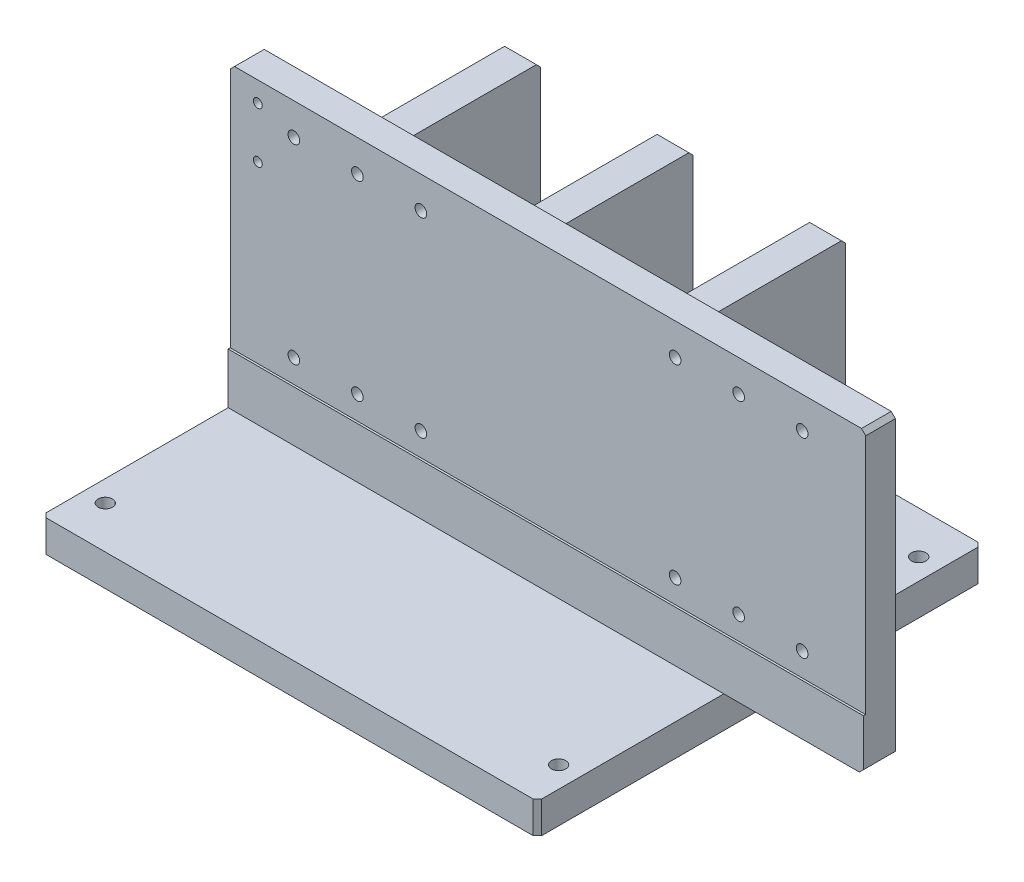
SolidWorks part; units mm, degrees
ref_plane "정면" through (0, 0, 0) normal (0, 0, 1) x (1, 0, 0)
ref_plane "윗면" through (0, 0, 0) normal (0, 1, 0) x (1, 0, 0)
ref_plane "우측면" through (0, 0, 0) normal (1, 0, 0) x (0, 0, -1)
sketch "스케치1" plane through (0, 0, 0) normal (0, 1, 0) x (1, 0, 0)
  line L1 (-117, 105) -> (117, 105)
  line L2 (-117, 105) -> (-117, -105)
  line L3 (-117, -105) -> (117, -105)
  line L4 (117, 105) -> (117, -105)
  line L5 (-117, 105) -> (117, -105) construction
  line L6 (-117, -105) -> (117, 105) construction
  point P0 (0, 0)
  dimension "D1" = 234
  dimension "D2" = 210
extrude "보스-돌출1" add sketch "스케치1" along normal blind 15
sketch "스케치2" plane through (0, 15, 0) normal (0, 1, 0) x (1, 0, 0)
  line L0 (-117, 105) -> (-117, -105) construction
  line L1 (-117, -2) -> (183, -2)
  line L2 (-117, -2) -> (-117, -17)
  line L3 (-117, -17) -> (183, -17)
  line L4 (183, -2) -> (183, -17)
  line L5 (117, 105) -> (-117, 105) construction
  dimension "D1" = 15
  dimension "D2" = 300
  dimension "D3" = 107
extrude "보스-돌출2" add sketch "스케치2" along normal blind 140 separate body
sketch "스케치3" plane through (0, 0, 17) normal (0, 0, 1) x (1, 0, 0)
  line L0 (183, 155) -> (183, 15) construction
  line L1 (-117, 155) -> (183, 155)
  line L2 (-117, 155) -> (-117, 39)
  line L3 (-117, 39) -> (183, 39)
  line L4 (183, 155) -> (183, 39)
  line L5 (-117, 15) -> (117, 15) construction
  dimension "D1" = 24
extrude "컷-돌출1" cut sketch "스케치3" against normal blind 1
sketch "스케치4" plane through (0, 15, 0) normal (0, 1, 0) x (1, 0, 0)
  line L1 (-79.5, 78) -> (-64.5, 78)
  line L2 (-79.5, 78) -> (-79.5, -2)
  line L3 (-79.5, -2) -> (-64.5, -2)
  line L4 (-64.5, 78) -> (-64.5, -2)
  line L5 (183, -2) -> (-117, -2) construction
  line L6 (-117, 105) -> (-117, -105) construction
  line L7 (-7.5, 78) -> (7.5, 78)
  line L8 (-7.5, 78) -> (-7.5, -2)
  line L9 (-7.5, -2) -> (7.5, -2)
  line L10 (7.5, 78) -> (7.5, -2)
  line L11 (64.5, 78) -> (79.5, 78)
  line L12 (64.5, 78) -> (64.5, -2)
  line L13 (64.5, -2) -> (79.5, -2)
  line L14 (79.5, 78) -> (79.5, -2)
  dimension "D1" = 37.5
  dimension "D2" = 15
  dimension "D3" = 57
  dimension "D4" = 57
  dimension "D5" = 80
extrude "보스-돌출3" add sketch "스케치4" along normal blind 120 separate body
sketch "스케치5" plane through (79.5, 0, 0) normal (1, 0, 0) x (0, 0, -1)
  line L0 (78, 135) -> (76, 135)
  line L1 (-2, 135) -> (78, 135) construction
  line L2 (76, 135) -> (78, 133)
  line L3 (78, 135) -> (78, 15) construction
  line L4 (78, 133) -> (78, 135)
  dimension "D1" = 2
  dimension "D2" = 2
extrude "컷-돌출2" cut sketch "스케치5" against normal through all
hole_wizard "M8 나사 구멍1" positions "스케치6" profile "스케치7" tap size "M8" standard "ISO"
sketch "스케치6" plane through (0, 15, 0) normal (0, 1, 0) x (1, 0, 0)
  line L0 (117, -105) -> (117, 105) construction
  line L1 (117, 105) -> (-117, 105) construction
  point P0 (-107, 85)
  point P2 (107, 85)
  point P4 (-107, -85)
  point P6 (107, -85)
  dimension "D1" = 214
  dimension "D2" = 10
  dimension "D3" = 20
  dimension "D4" = 170
sketch "스케치7" plane through (-107, 15, -85) normal (1, 0, 0) x (0, 0, 1)
  line L0 (0, 0) -> (0, 15)
  line L1 (0, 15) -> (3.4, 15)
  line L2 (3.4, 15) -> (3.4, 0)
  line L5 (3.4, 0) -> (0, 0)
  line L11 (0, -6.35) -> (0, 107.95) construction
  dimension "관통 탭 드릴 지름" = 6.8
  dimension "관통 탭 드릴 깊이" = 15
hole_wizard "Ø6.0mm 맞춤핀 구멍1" positions "스케치8" profile "스케치9" hole size "Ø6.0" standard "ISO"
sketch "스케치8" plane through (0, 0, 0) normal (0, -1, 0) x (-1, 0, 0)
  line L0 (0, 0) -> (-155.2193, 0) construction
  line L1 (-117, -105) -> (-117, 105) construction
  point P6 (-107, 0)
  point P8 (107, 0)
  dimension "D1" = 214
  dimension "D2" = 10
sketch "스케치9" plane through (-107, 0, 0) normal (1, 0, 0) x (0, 0, -1)
  line L0 (0, 0) -> (0, 11.8026)
  line L1 (0, 11.8026) -> (3, 10)
  line L2 (3, 10) -> (3, 0)
  line L5 (3, 0) -> (0, 0)
  line L10 (0, 11.8026) -> (-3, 10) construction
  line L11 (0, -6.35) -> (0, 107.95) construction
  dimension "구멍 지름" = 6
  dimension "구멍 깊이" = 10
  dimension "드릴 각도" = 118
hole_wizard "M5 나사 구멍1" positions "스케치10" profile "스케치11" tap size "M5" standard "ISO"
sketch "스케치10" plane through (-117, 0, 0) normal (-1, 0, 0) x (0, 0, 1)
  line L0 (-105, 15) -> (-105, 0) construction
  line L1 (-105, 0) -> (105, 0) construction
  point P0 (-45, 7.5)
  point P2 (-9, 7.5)
  dimension "D1" = 36
  dimension "D2" = 60
  dimension "D3" = 7.5
sketch "스케치11" plane through (-117, 7.5, -45) normal (0, 1, 0) x (0, 0, 1)
  line L0 (0, 0) -> (0, 13.2618)
  line L1 (0, 13.2618) -> (2.1, 12)
  line L2 (2.1, 12) -> (2.1, 0)
  line L5 (2.1, 0) -> (0, 0)
  line L10 (0, 13.2618) -> (-2.1, 12) construction
  line L11 (0, -6.35) -> (0, 107.95) construction
  dimension "탭 드릴 지름" = 4.2
  dimension "탭 드릴 깊이" = 12
  dimension "드릴 각도" = 118
hole_wizard "M5 소켓 머리 캡 나사용 카운터보어1" positions "스케치12" profile "스케치13" counterbore size "M5" standard "KS"
sketch "스케치12" plane through (0, 0, 2) normal (0, 0, -1) x (-1, 0, 0)
  line L0 (117, 155) -> (117, 15) construction
  line L1 (-183, 15) -> (117, 15) construction
  point P0 (27, 140)
  point P2 (57, 140)
  point P4 (87, 140)
  point P6 (27, 50)
  point P8 (57, 50)
  point P10 (87, 50)
  dimension "D1" = 30
  dimension "D2" = 30
  dimension "D3" = 30
  dimension "D4" = 90
  dimension "D5" = 35
sketch "스케치13" plane through (-27, 140, 2) normal (1, 0, 0) x (0, 1, 0)
  line L0 (0, 0) -> (0, 103)
  line L1 (0, 103) -> (2.75, 103)
  line L3 (2.75, 103) -> (2.75, 7)
  line L4 (2.75, 7) -> (4.75, 7)
  line L5 (4.75, 7) -> (4.75, 0)
  line L7 (4.75, 0) -> (0, 0)
  line L11 (0, -6.35) -> (0, 107.95) construction
  dimension "관통 구멍 지름" = 5.5
  dimension "관통 구멍 깊이" = 103
  dimension "카운터보어 지름" = 9.5
  dimension "카운터보어 깊이" = 7
pattern_linear "선형 패턴1" count 2 spacing 180 along (1, 0, 0) of "M5 소켓 머리 캡 나사용 카운터보어1"
hole_wizard "M5 나사 구멍2" positions "스케치14" profile "스케치15" tap size "M5" standard "ISO"
sketch "스케치14" plane through (0, 0, 2) normal (0, 0, -1) x (-1, 0, 0)
  line L0 (-183, 155) -> (117, 155) construction
  line L1 (117, 155) -> (117, 15) construction
  point P0 (104, 145.5)
  point P2 (104, 121.5)
  dimension "D1" = 24
  dimension "D2" = 9.5
  dimension "D3" = 13
sketch "스케치15" plane through (-104, 145.5, 2) normal (1, 0, 0) x (0, 1, 0)
  line L0 (0, 0) -> (0, 103)
  line L1 (0, 103) -> (2.525, 103)
  line L2 (2.1, 102.575) -> (2.1, 0.425)
  line L3 (2.1, 0.425) -> (2.525, 0)
  line L5 (2.525, 0) -> (0, 0)
  line L6 (-2.1, 0.425) -> (-2.525, 0) construction
  line L7 (2.525, 103) -> (2.1, 102.575)
  line L8 (-2.525, 103) -> (-2.1, 102.575) construction
  line L11 (0, -6.35) -> (0, 107.95) construction
  dimension "관통 탭 드릴 지름" = 4.2
  dimension "관통 탭 드릴 깊이" = 103
  dimension "표면 카운터싱크 지름" = 5.05
  dimension "표면 카운터싱크 각도" = 90
  dimension "안쪽면 카운터싱크 지름" = 5.05
  dimension "안쪽면 카운터싱크 각도" = 90
chamfer "모따기1" distance 2 angle 45 3 edges at (-117, 155, 9) (183, 15, 9.5) (183, 155, 9)
chamfer "모따기2" distance 2 angle 45 4 edges at (-117, 7.5, 105) (117, 7.5, 105) (-117, 7.5, -105) (117, 7.5, -105)
